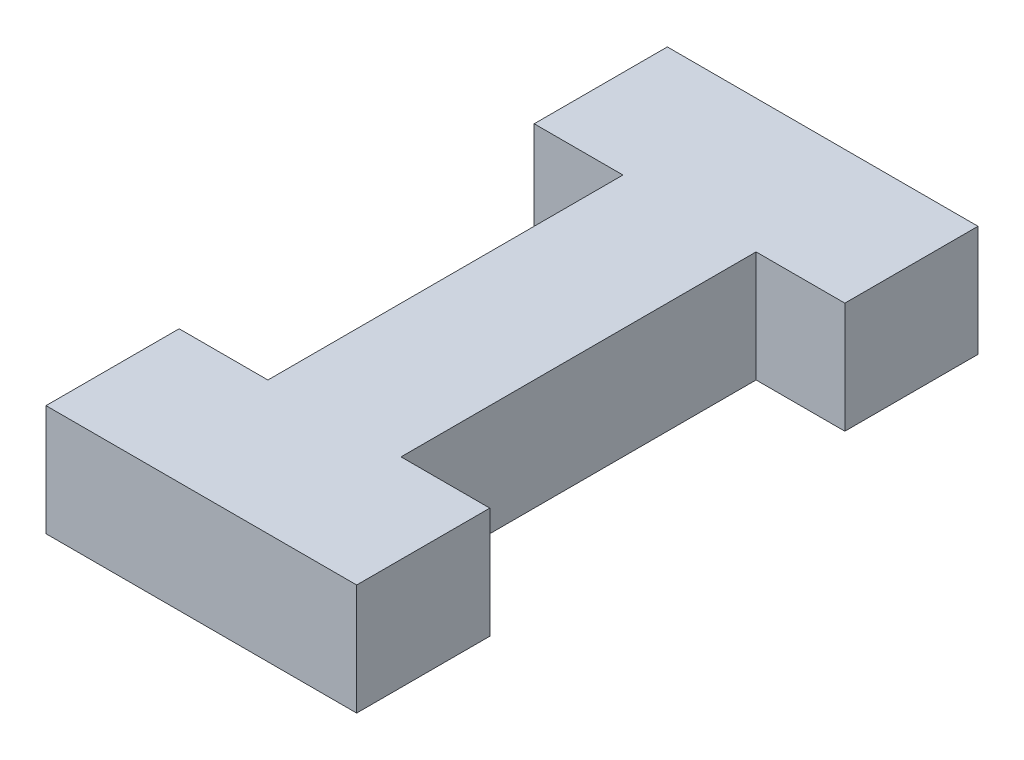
SolidWorks part; units mm, degrees
ref_plane "Front Plane" through (0, 0, 0) normal (0, 0, 1) x (1, 0, 0)
ref_plane "Top Plane" through (0, 0, 0) normal (0, 1, 0) x (1, 0, 0)
ref_plane "Right Plane" through (0, 0, 0) normal (1, 0, 0) x (0, 0, -1)
sketch "Sketch1" plane through (0, 0, 0) normal (0, 1, 0) x (1, 0, 0)
  line L0 (0, -7) -> (0, 7) construction
  line L1 (3.5, 7) -> (-3.5, 7)
  line L2 (-3.5, 7) -> (-3.5, 4)
  line L3 (-3.5, 4) -> (-1.5, 4)
  line L4 (-1.5, 4) -> (-1.5, -4)
  line L5 (-1.5, -4) -> (-3.5, -4)
  line L6 (-3.5, -4) -> (-3.5, -7)
  line L7 (-3.5, -7) -> (3.5, -7)
  line L8 (3.5, -4) -> (3.5, -7)
  line L9 (1.5, -4) -> (3.5, -4)
  line L10 (1.5, 4) -> (1.5, -4)
  line L11 (3.5, 4) -> (1.5, 4)
  line L12 (3.5, 7) -> (3.5, 4)
  point P4 (0, 0)
  point P8 (0, 7)
  dimension "D1" = 14
  dimension "D2" = 3
  dimension "D3" = 7
  dimension "D4" = 8
extrude "Boss-Extrude1" add sketch "Sketch1" along normal blind 2.5 contours L3 L4 L5 L6 L7 L8 L9 L10 L11 L12 L1 L2
